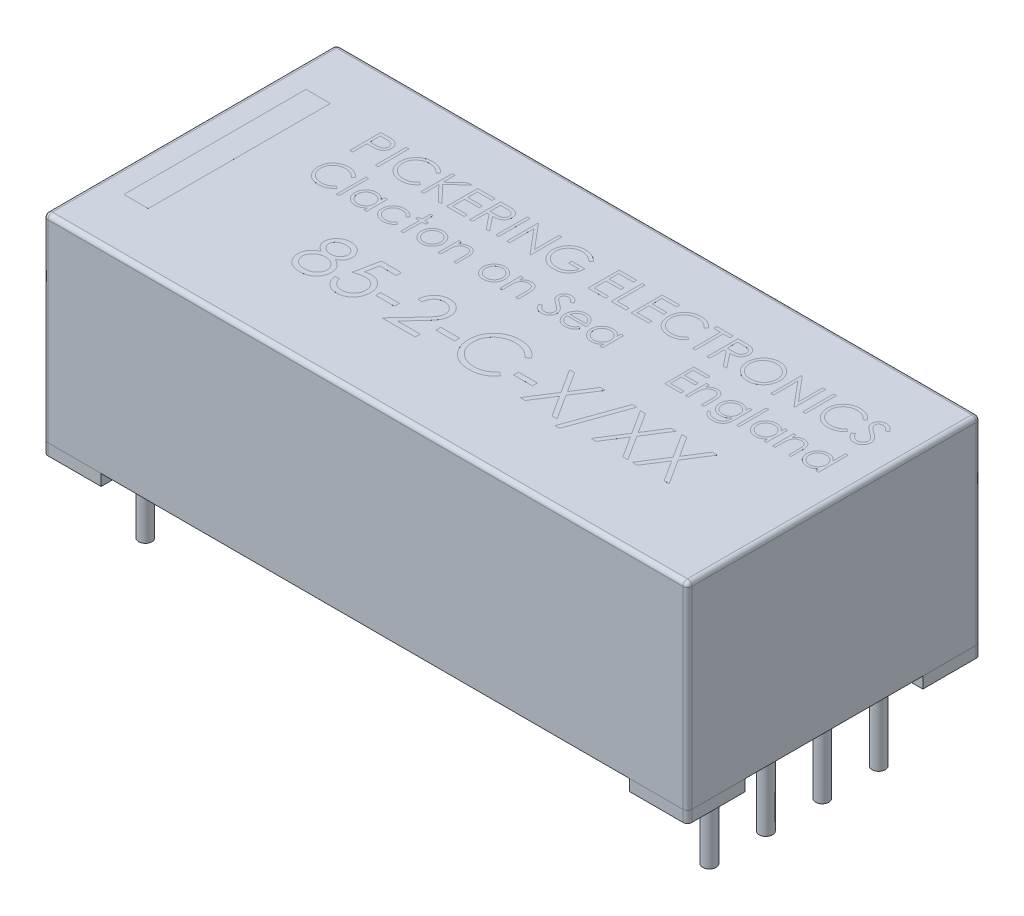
SolidWorks part; units mm, degrees
ref_plane "Front Plane" through (0, 0, 0) normal (0, 0, 1) x (1, 0, 0)
ref_plane "Top Plane" through (0, 0, 0) normal (0, 1, 0) x (1, 0, 0)
ref_plane "Right Plane" through (0, 0, 0) normal (1, 0, 0) x (0, 0, -1)
sketch "Sketch2" plane through (0, 0, 0) normal (0, 1, 0) x (1, 0, 0)
  line L1 (14.5, -6.6) -> (-14.5, -6.6)
  line L2 (14.5, -6.6) -> (14.5, 6.6)
  line L3 (14.5, 6.6) -> (-14.5, 6.6)
  line L4 (-14.5, -6.6) -> (-14.5, 6.6)
  line L5 (14.5, -6.6) -> (-14.5, 6.6) construction
  line L6 (14.5, 6.6) -> (-14.5, -6.6) construction
  point P0 (0, 0)
  dimension "D1" = 13.2
  dimension "D2" = 29
extrude "Main Body" add sketch "Sketch2" along normal blind 8.89 draft 0.023
sketch "Sketch9" plane through (0, 0, 0) normal (0, -1, 0) x (1, 0, 0)
  line L0 (14.5, -6.6) -> (-14.5, -6.6) construction
  line L1 (14.5, 6.6) -> (14.5, -6.6) construction
  circle A0 centre (12.7, -3.81) radius 0.3
  circle A1 centre (12.7, -1.27) radius 0.2963
  circle A2 centre (12.7, 1.27) radius 0.3
  circle A3 centre (12.7, 3.81) radius 0.3
  dimension "D1" = 0.6
  dimension "D5" = 0.6
  dimension "D7" = 0.6
  dimension "D2" = 2.79
  dimension "D3" = 2.54
  dimension "D4" = 1.8
  dimension "D6" = 2.54
  dimension "D8" = 2.54
extrude "Pins" add sketch "Sketch9" along normal blind 4.31
mirror "Mirror2" about plane through (0, 0, 0) normal (1, 0, 0) of "Pins"
sketch "Sketch10" plane through (0, 0, 0) normal (0, -1, 0) x (1, 0, 0)
  line L1 (14.5, 6.6) -> (11.9, 6.6)
  line L2 (14.5, 6.6) -> (14.5, 4)
  line L3 (14.5, 4) -> (11.9, 4)
  line L4 (11.9, 6.6) -> (11.9, 4)
  dimension "D1" = 2.6
  dimension "D2" = 2.6
extrude "Foot" add sketch "Sketch10" along normal blind 0.51
sketch "Sketch11" plane through (0, -0.51, 0) normal (0, -1, 0) x (1, 0, 0)
  line L0 (14.5, 6.6) -> (11.9, 6.6) construction
  line L1 (11.9, 4) -> (13.95, 4)
  line L2 (11.9, 4) -> (11.9, 6.05)
  line L3 (11.9, 6.05) -> (13.95, 6.05)
  line L4 (13.95, 4) -> (13.95, 6.05)
  line L5 (14.5, 4) -> (14.5, 6.6) construction
  dimension "D1" = 0.55
  dimension "D2" = 0.55
extrude "Extrude2" cut sketch "Sketch11" against normal up to surface (0.51 mm away)
mirror "Mirror3" about plane through (0, 0, 0) normal (0, 0, 1) of "Extrude2", "Foot"
mirror "Mirror4" about plane through (0, 0, 0) normal (1, 0, 0) of "Mirror3", "Foot", "Extrude2"
sketch "Sketch12"
  dimension "D1" = 1.1
  dimension "D2" = 8.2
  dimension "D3" = 2.4965
  dimension "D4" = 1.4
  dimension "D5" = 2
  dimension "D6" = 3.8
extrude "Lettering" add sketch "Sketch12" along normal blind 0.0001
fillet "Fillet1" radius 0.2 12 edges at (-14.5, -0.255, -6.6) (14.5, -0.255, -6.6) (14.5, -0.255, 6.6) (-14.5, -0.255, 6.6) (-14.4983, 4.445, -6.5983) (14.4983, 4.445, -6.5983) (0, 8.89, -6.5965) (14.4983, 4.445, 6.5983) (14.4965, 8.89, 0) (-14.4983, 4.445, 6.5983) (-14.4965, 8.89, 0) (0, 8.89, 6.5965)
